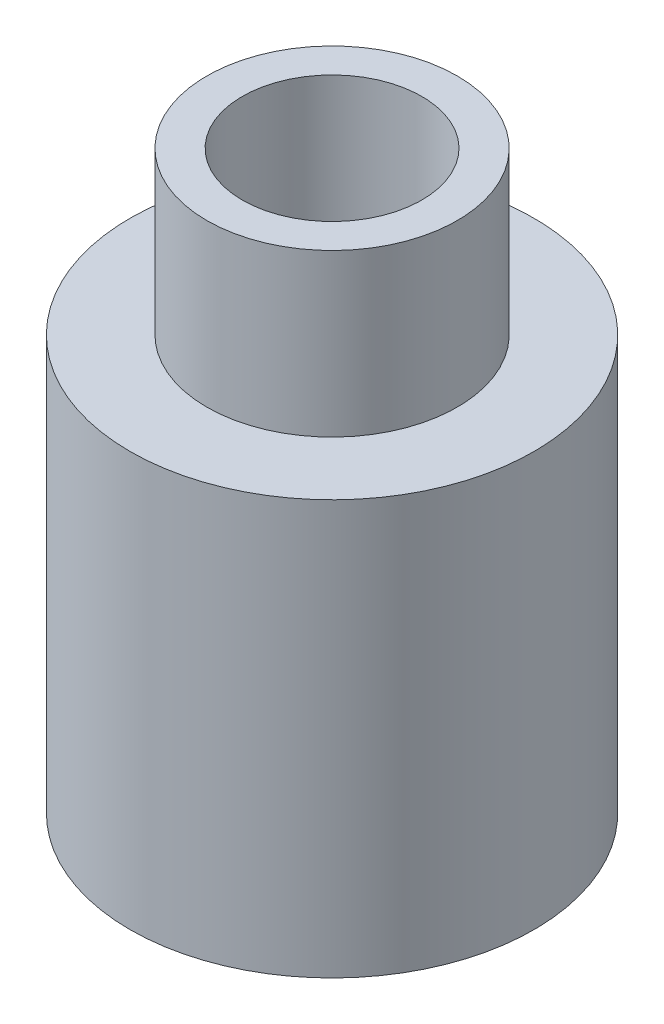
SolidWorks part; units mm, degrees
ref_plane "Front Plane" through (0, 0, 0) normal (0, 0, 1) x (1, 0, 0)
ref_plane "Top Plane" through (0, 0, 0) normal (0, 1, 0) x (1, 0, 0)
ref_plane "Right Plane" through (0, 0, 0) normal (1, 0, 0) x (0, 0, -1)
sketch "Sketch3" plane through (0, 0, 0) normal (0, 1, 0) x (1, 0, 0)
  circle A0 centre (0, 0) radius 2
extrude "Boss-Extrude2" add sketch "Sketch3" along normal blind 4.1
sketch "Sketch4" plane through (0, 4.1, 0) normal (0, 1, 0) x (1, 0, 0)
  circle A0 centre (0, 0) radius 1.24
extrude "Boss-Extrude3" add sketch "Sketch4" along normal blind 1.6
sketch "Sketch6" plane through (0, 5.7, 0) normal (0, 1, 0) x (1, 0, 0)
  point P0 (0, 0)
  point P1 (0, 0)
sketch "Sketch10" plane through (0, 0, 0) normal (0, -1, 0) x (1, 0, 0)
  point P0 (0, 0)
  point P3 (0, 0)
  point P4 (0, 0)
  point P5 (0, 0)
  point P6 (0, 0)
hole_wizard "#2-56 Tapped Hole1" positions "Sketch12" profile "Sketch11" tap size "#2-56" standard "ANSI Inch"
sketch "Sketch12" plane through (0, 5.7, 0) normal (0, 1, 0) x (1, 0, 0)
  point P0 (0, 0)
sketch "Sketch11" plane through (0, 5.7, 0) normal (1, 0, 0) x (0, 0, 1)
  line L0 (0, 0) -> (0, 3.7092)
  line L1 (0, 3.7092) -> (0.889, 3.175)
  line L2 (0.889, 3.175) -> (0.889, 0)
  line L5 (0.889, 0) -> (0, 0)
  line L10 (0, 3.7092) -> (-0.889, 3.175) construction
  line L11 (0, -6.35) -> (0, 107.95) construction
  dimension "Tap Drill Dia." = 1.778
  dimension "Tap Drill Depth" = 3.175
  dimension "Drill Angle" = 118
